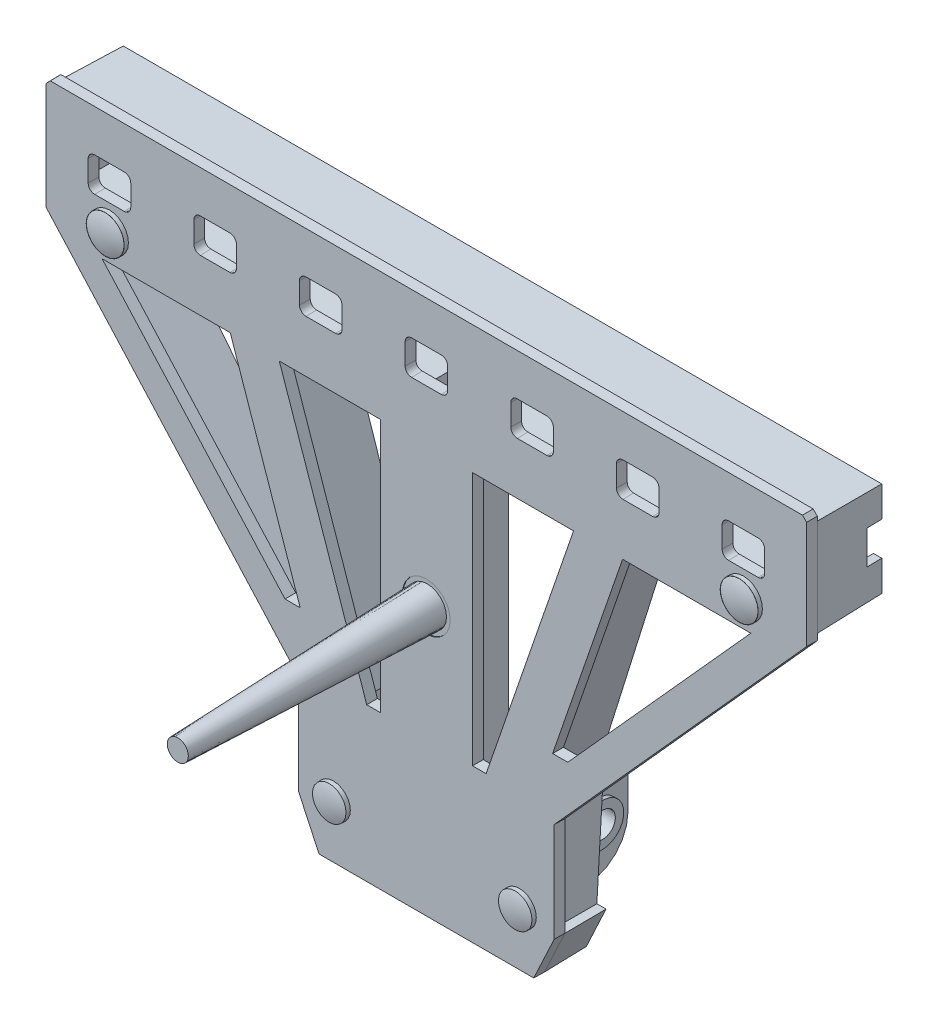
SolidWorks part; units mm, degrees
ref_plane "Plan de face" through (0, 0, 0) normal (0, 0, 1) x (1, 0, 0)
ref_plane "Plan de dessus" through (0, 0, 0) normal (0, 1, 0) x (1, 0, 0)
ref_plane "Plan de droite" through (0, 0, 0) normal (1, 0, 0) x (0, 0, -1)
imported_body "Importée1"
sketch "Esquisse1" plane through (0, 0, 2.55) normal (0, 0, 1) x (1, 0, 0)
  circle A0 centre (0, 0) radius 2.55
  dimension "D1" = 5.1
extrude "Extrusion1" add sketch "Esquisse1" along normal blind 60
sketch "Esquisse2" plane through (0, 0, 2.55) normal (0, 0, 1) x (1, 0, 0)
  circle A0 centre (0, 0) radius 5.7541
  circle A1 centre (0, 0) radius 2.55 construction
  circle A2 centre (0, 0) radius 2.55
extrude "Extrusion4" cut sketch "Esquisse2" against normal blind 0.2
draft "Dépouille1" type of draft neutral plane draft angle 2 faces to draft 1 parameters "D1"=2
